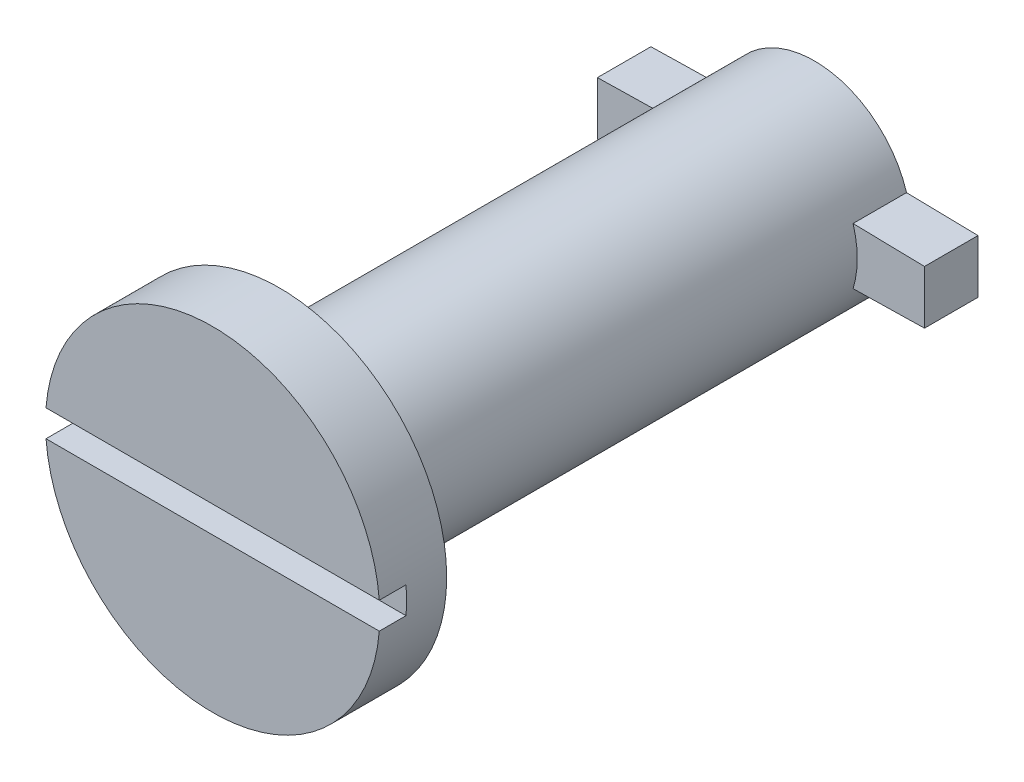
SolidWorks part; units mm, degrees
ref_plane "Alzado" through (0, 0, 0) normal (0, 0, 1) x (1, 0, 0)
ref_plane "Planta" through (0, 0, 0) normal (0, 1, 0) x (1, 0, 0)
ref_plane "Vista lateral" through (0, 0, 0) normal (1, 0, 0) x (0, 0, -1)
sketch "Croquis1" plane through (0, 0, 0) normal (0, 0, 1) x (1, 0, 0)
  circle A1 centre (29.1872, 25) radius 7.2
  dimension "D1" = 14.4
extrude "Saliente-Extruir1" add sketch "Croquis1" against normal blind 40
sketch "Croquis2" plane through (0, 0, 0) normal (0, 0, 1) x (1, 0, 0)
  circle A0 centre (29.1872, 25) radius 12.5
  dimension "D1" = 25
extrude "Saliente-Extruir2" add sketch "Croquis2" along normal blind 5
sketch "Croquis3" plane through (0, 0, 5) normal (0, 0, 1) x (1, 0, 0)
  line L0 (29.1872, 25) -> (29.1872, 37.5) construction
  line L1 (30.1872, 26) -> (41.6872, 26)
  line L3 (16.6872, 24) -> (30.1872, 24)
  line L5 (16.6872, 26) -> (30.1872, 26)
  line L7 (30.1872, 24) -> (41.6872, 24)
  line L9 (16.6872, 26) -> (16.6872, 24)
  line L11 (41.6872, 24) -> (41.6872, 26)
extrude "Cortar-Extruir1" cut sketch "Croquis3" against normal blind 2
sketch "Croquis4" plane through (0, 0, -40) normal (0, 0, -1) x (-1, 0, 0)
  line L9 (-16.9588, 23) -> (-16.9588, 27) construction
  line L10 (-16.9588, 27) -> (-21.9876, 27.1015) construction
  line L11 (-21.9876, 22.8985) -> (-16.9588, 23) construction
  line L12 (-36.3868, 27.1015) -> (-41.4156, 27) construction
  line L13 (-41.4156, 27) -> (-41.4156, 23) construction
  line L14 (-41.4156, 23) -> (-36.3868, 22.8985) construction
  line L15 (-16.9588, 23) -> (-16.9588, 27)
  line L16 (-16.9588, 27) -> (-22.3027, 27.1079)
  line L17 (-22.3027, 22.8921) -> (-16.9588, 23)
  line L18 (-36.0717, 27.1079) -> (-41.4156, 27)
  line L19 (-41.4156, 27) -> (-41.4156, 23)
  line L20 (-41.4156, 23) -> (-36.0717, 22.8921)
  circle A3 centre (-29.1872, 25) radius 7.2 construction
  arc A4 (-36.0717, 22.8921) -> (-22.3027, 22.8921) centre (-29.1872, 25) ccw
  arc A5 (-22.3027, 27.1079) -> (-36.0717, 27.1079) centre (-29.1872, 25) ccw
extrude "Saliente-Extruir3" add sketch "Croquis4" against normal blind 4
sketch "Croquis6" plane through (0, 0, -40) normal (0, 0, -1) x (-1, 0, 0)
  circle A0 centre (-29.1872, 25) radius 5.2
  arc A1 (-22.3027, 27.1079) -> (-36.0717, 27.1079) centre (-29.1872, 25) ccw construction
  dimension "D1" = 2
extrude "Cortar-Extruir3" cut sketch "Croquis6" against normal blind 30
